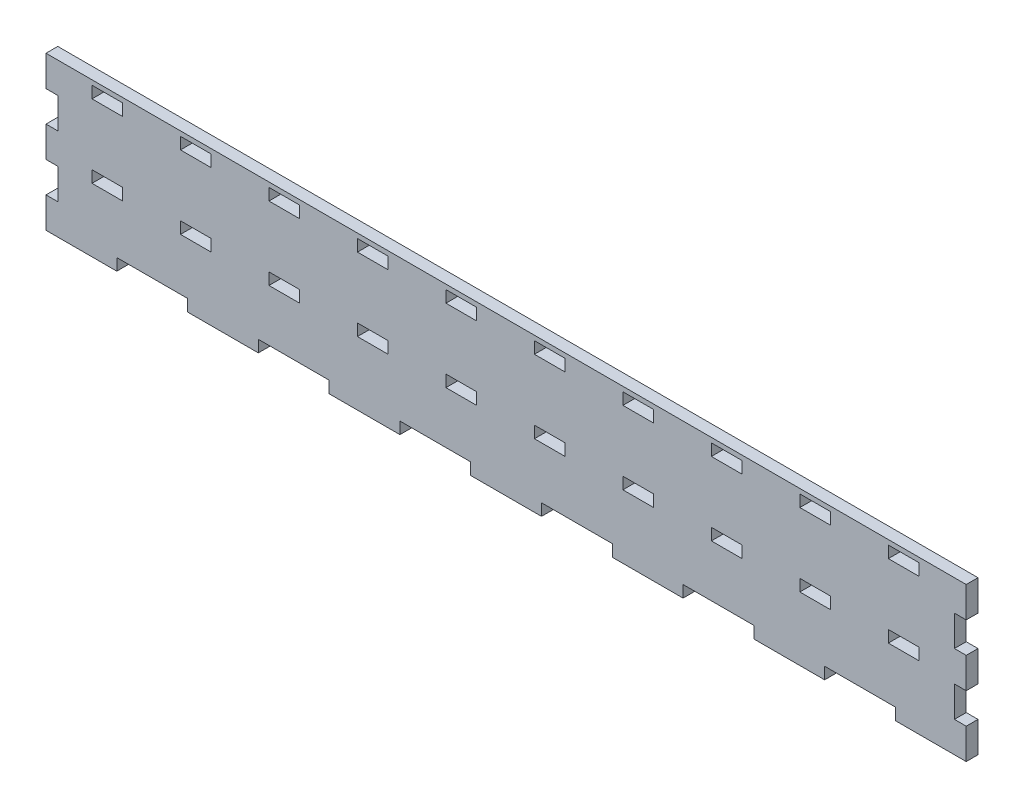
SolidWorks part; units mm, degrees
ref_plane "Plan de face" through (0, 0, 0) normal (0, 0, 1) x (1, 0, 0)
ref_plane "Plan de dessus" through (0, 0, 0) normal (0, 1, 0) x (1, 0, 0)
ref_plane "Plan de droite" through (0, 0, 0) normal (1, 0, 0) x (0, 0, -1)
sketch "Esquisse1" plane through (0, 0, 0) normal (0, 0, 1) x (1, 0, 0)
  line L1 (0, 0) -> (390, 0)
  line L2 (0, 0) -> (0, -65)
  line L3 (0, -65) -> (390, -65)
  line L4 (390, 0) -> (390, -65)
extrude "Boss.-Extru.1" add sketch "Esquisse1" along normal blind 5
sketch "Esquisse2" plane through (0, 0, 5) normal (0, 0, 1) x (1, 0, 0)
  line L0 (0, -65) -> (390, -65) construction
  line L1 (30, -65) -> (60, -65)
  line L2 (30, -65) -> (30, -60)
  line L3 (30, -60) -> (60, -60)
  line L4 (60, -65) -> (60, -60)
  line L5 (0, 0) -> (390, 0) construction
  line L6 (0, 0) -> (0, -65) construction
extrude "Enlèv. mat.-Extru.1" cut sketch "Esquisse2" against normal blind 5
pattern_linear "Répétition linéaire1" count 6 spacing 60 along (1, 0, 0) of "Enlèv. mat.-Extru.1"
sketch "Esquisse3" plane through (0, 0, 5) normal (0, 0, 1) x (1, 0, 0)
  line L0 (0, 0) -> (0, -65) construction
  line L1 (0, -52) -> (5, -52)
  line L2 (0, -52) -> (0, -39)
  line L3 (0, -39) -> (5, -39)
  line L4 (5, -52) -> (5, -39)
  line L5 (0, 0) -> (0, -65) construction
  line L6 (0, -65) -> (30, -65) construction
extrude "Enlèv. mat.-Extru.2" cut sketch "Esquisse3" against normal blind 5
pattern_linear "Répétition linéaire2" count 2 spacing 26 along (0, 1, 0) of "Enlèv. mat.-Extru.2"
ref_plane "Plan1" through (195, 0, 0) normal (-1, 0, 0) x (0, 0, 1)
mirror "Symétrie1" about plane through (195, 0, 0) normal (-1, 0, 0) of "Répétition linéaire2", "Enlèv. mat.-Extru.2"
sketch "Esquisse4" plane through (0, 0, 5) normal (0, 0, 1) x (1, 0, 0)
  line L1 (57, -33) -> (70, -33)
  line L2 (57, -33) -> (57, -38)
  line L3 (57, -38) -> (70, -38)
  line L4 (70, -33) -> (70, -38)
  line L5 (57, -2) -> (70, -2)
  line L6 (0, -26) -> (0, -39) construction
  line L7 (60, -65) -> (90, -65) construction
  line L8 (57, -2) -> (57, -7)
  line L9 (57, -7) -> (70, -7)
  line L10 (70, -2) -> (70, -7)
  point P6 (63.5, -33)
extrude "Enlèv. mat.-Extru.3" cut sketch "Esquisse4" against normal blind 5
pattern_linear "Répétition linéaire3" count 2 spacing 37.5 along (-1, 0, 0) count 9 spacing 37.5 along (1, 0, 0) of "Enlèv. mat.-Extru.3"
equation "\"D1@Esquisse1\"=400-10"
equation "\"D2@Esquisse2\"=\"D1@Esquisse2\"/13"
equation "\"D3@Esquisse2\"=\"D1@Esquisse2\"/13"
equation "\"D2@Esquisse3\"=\"D1@Esquisse3\"/5"
equation "\"D3@Esquisse3\"=\"D1@Esquisse3\"/5"
equation "\"D6@Esquisse4\"=\"D2@Esquisse4\""
